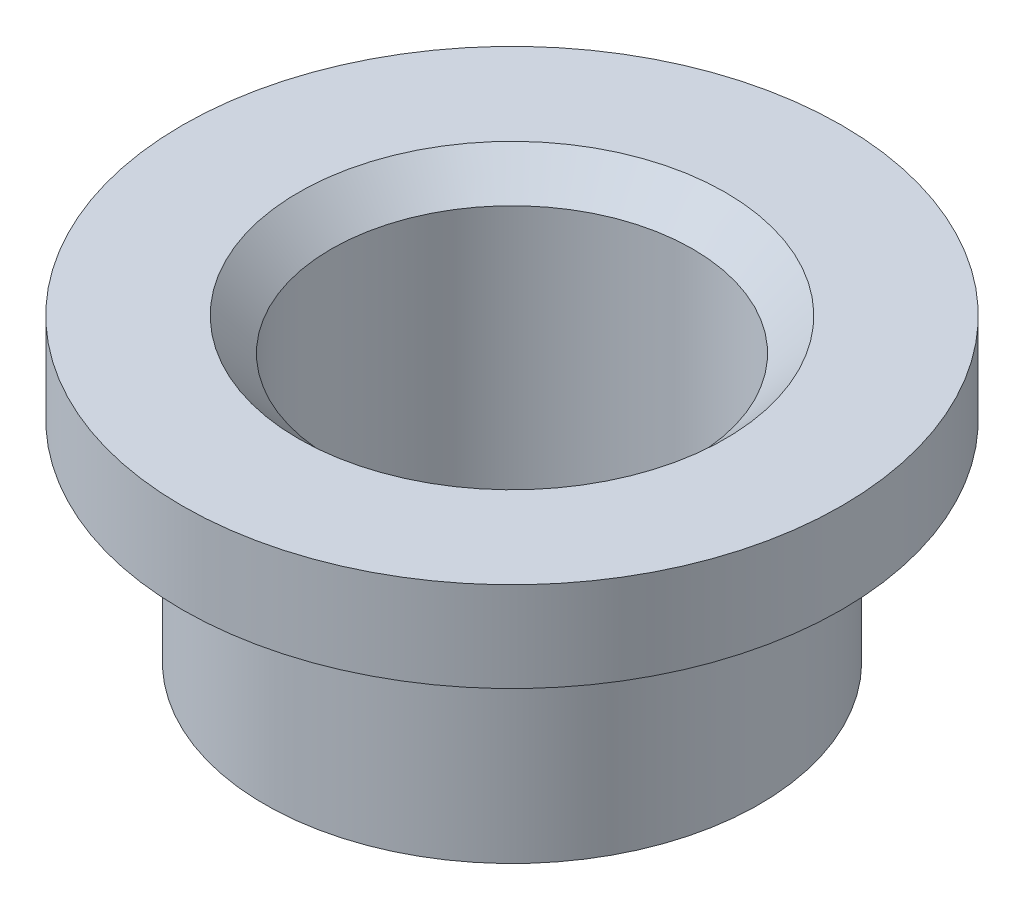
SolidWorks part; units mm, degrees
ref_plane "Front Plane" through (0, 0, 0) normal (0, 0, 1) x (1, 0, 0)
ref_plane "Top Plane" through (0, 0, 0) normal (0, 1, 0) x (1, 0, 0)
ref_plane "Right Plane" through (0, 0, 0) normal (1, 0, 0) x (0, 0, -1)
sketch "Sketch1" plane through (0, 0, 0) normal (0, 1, 0) x (1, 0, 0)
  circle A0 centre (0, 0) radius 13.97
extrude "Boss-Extrude1" add sketch "Sketch1" along normal blind 3.81
sketch "Sketch2" plane through (0, 0, 0) normal (0, -1, 0) x (1, 0, 0)
  circle A0 centre (0, 0) radius 10.4775
extrude "Boss-Extrude2" add sketch "Sketch2" along normal blind 8.89
hole_wizard "3/8-18 NPSM Tapped Hole1" positions "3DSketch1" profile "Sketch3" tap size "3/8-18 NPSM" standard "ANSI Inch"
sketch3d "3DSketch1"
  point P0 (0, 0, 0)
  point P3 (0, 3.81, 0)
  point P6 (0, 0, 0)
  point P8 (0, 3.81, 0)
  point P9 (0, 0, 0)
sketch "Sketch3" plane through (0, 3.81, 0) normal (1, 0, 0) x (0, 0, 1)
  line L0 (0, 0) -> (0, 12.7)
  line L1 (0, 12.7) -> (7.6581, 12.7)
  line L2 (7.6581, 12.7) -> (7.6581, 1.3843)
  line L3 (7.6581, 1.3843) -> (9.0424, 0)
  line L5 (9.0424, 0) -> (0, 0)
  line L6 (-7.6581, 1.3843) -> (-9.0424, 0) construction
  line L11 (0, -6.35) -> (0, 107.95) construction
  dimension "Thru Tap Drill Dia." = 15.3162
  dimension "Thru Tap Drill Depth" = 12.7
  dimension "Near C'Sink Dia." = 18.0848
  dimension "Near C'Sink Angle" = 90
